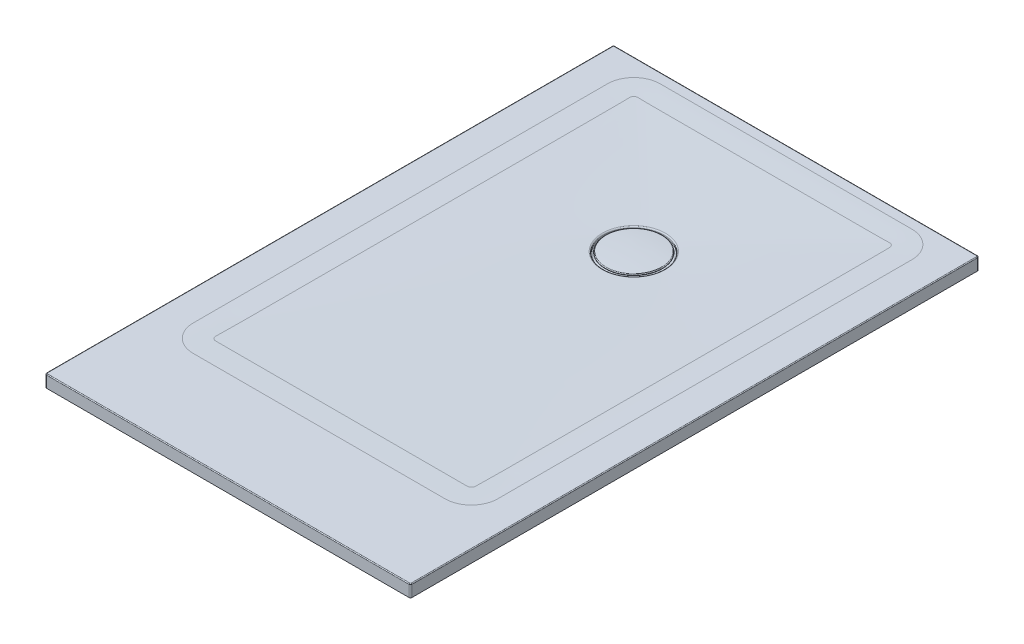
SolidWorks part; units mm, degrees
ref_plane "Płaszczyzna przednia" through (0, 0, 0) normal (0, 0, 1) x (1, 0, 0)
ref_plane "Płaszczyzna górna" through (0, 0, 0) normal (0, 1, 0) x (1, 0, 0)
ref_plane "Płaszczyzna prawa" through (0, 0, 0) normal (1, 0, 0) x (0, 0, -1)
sketch "Szkic2" plane through (0, 0, 0) normal (0, 1, 0) x (1, 0, 0)
  line L0 (0, 700) -> (0, 300) construction
  line L1 (-450, -700) -> (450, -700)
  line L2 (-450, -700) -> (-450, 700)
  line L3 (-450, 700) -> (450, 700)
  line L4 (450, -700) -> (450, 700)
  line L5 (-450, -700) -> (450, 700) construction
  line L6 (-450, 700) -> (450, -700) construction
  line L7 (-360, 660) -> (360, 660)
  line L8 (-360, 660) -> (-360, -460)
  line L9 (-360, -460) -> (360, -460)
  line L10 (360, 660) -> (360, -460)
  line L11 (-400, 700) -> (-400, -500) construction
  line L12 (-400, -500) -> (400, -500) construction
  line L13 (400, -500) -> (400, 700) construction
  circle A0 centre (0, 300) radius 75
  point P0 (0, 0)
  point P11 (0, 660)
  point P16 (0, -500)
  dimension "D9" = 150
  dimension "D1" = 900
  dimension "D2" = 1400
  dimension "D3" = 40
  dimension "D4" = 90
  dimension "D5" = 40
  dimension "D6" = 50
  dimension "D7" = 1200
  dimension "D8" = 400
  dimension "D10" = 800
sketch "Szkic3" plane through (0, 0, 0) normal (0, 1, 0) x (1, 0, 0)
  line L0 (-450, -700) -> (-450, 700) construction
  line L1 (-450, -700) -> (450, -700) construction
  line L2 (450, -700) -> (450, 700) construction
  line L3 (-450, 700) -> (450, 700) construction
  line L4 (-360, 660) -> (-360, -460) construction
  line L5 (-360, 660) -> (360, 660) construction
  line L6 (360, 660) -> (360, -460) construction
  line L7 (-360, -460) -> (360, -460) construction
  line L8 (-450, -700) -> (-450, 700)
  line L9 (-450, -700) -> (450, -700)
  line L10 (450, -700) -> (450, 700)
  line L11 (-450, 700) -> (450, 700)
  line L12 (-360, 610) -> (-360, -410)
  line L13 (-310, 660) -> (310, 660)
  line L14 (360, 610) -> (360, -410)
  line L15 (-310, -460) -> (310, -460)
  arc A0 (360, 610) -> (310, 660) centre (310, 610) ccw
  arc A1 (-310, 660) -> (-360, 610) centre (-310, 610) ccw
  arc A2 (310, -460) -> (360, -410) centre (310, -410) ccw
  arc A3 (-310, -460) -> (-360, -410) centre (-310, -410) cw
  dimension "D1" = 50
surface "Powierzchnia-Płaszczyzna1" sketch "Szkic3"
sketch "Szkic4" plane through (0, 0, 0) normal (0, 1, 0) x (1, 0, 0)
  line L0 (-360, 660) -> (-360, -460) construction
  line L1 (-360, -460) -> (360, -460) construction
  line L2 (360, 660) -> (360, -460) construction
  line L3 (-360, 660) -> (360, 660) construction
  line L4 (-360, 660) -> (-360, -460)
  line L5 (-360, -460) -> (360, -460)
  line L6 (360, 660) -> (360, -460)
  line L7 (-360, 660) -> (360, 660)
ref_plane "korek" through (0, -15, 0) normal (0, 1, 0) x (-1, 0, 0)
sketch "Szkic5" plane through (0, -15, 0) normal (0, 1, 0) x (-1, 0, 0)
  circle A0 centre (0, -300) radius 75 construction
  circle A1 centre (0, -300) radius 75
surface "Powierzchnia-Wyciągnięcie po profilach2"
surface "Powierzchnia-Połącz1"
sketch "Szkic7" plane through (0, 0, 0) normal (0, 1, 0) x (1, 0, 0)
  line L27 (310, 620) -> (-310, 620)
  line L28 (-320, 610) -> (-320, -410)
  line L29 (-310, -420) -> (310, -420)
  line L30 (320, -410) -> (320, 610)
  line L31 (310, 620) -> (-310, 620)
  line L32 (-320, 610) -> (-320, -410)
  line L33 (-310, -420) -> (310, -420)
  line L34 (320, -410) -> (320, 610)
  line L35 (310, 675) -> (-310, 675)
  line L36 (-375, 610) -> (-375, -410)
  line L37 (-310, -475) -> (310, -475)
  line L38 (375, -410) -> (375, 610)
  line L39 (310, 675) -> (-310, 675)
  line L40 (-375, 610) -> (-375, -410)
  line L41 (-310, -475) -> (310, -475)
  line L42 (375, -410) -> (375, 610)
  arc A0 (320, -410) -> (310, -420) centre (310, -410) cw
  arc A1 (-320, -410) -> (-310, -420) centre (-310, -410) ccw
  arc A2 (320, 610) -> (310, 620) centre (310, 610) ccw
  arc A3 (-320, 610) -> (-310, 620) centre (-310, 610) cw
  spline S23 degree 3 poles (-641.5878, 335.5068) (132.0266, 504.8459) (327.0345, 575.6218) (319.7449, 612.2672) (319.6662, 612.5839) (319.476, 613.2116) (319.3643, 613.5237) (318.9884, 614.4316) (318.6816, 615.0058) (318.1379, 615.8207) (317.942, 616.0854) (317.5242, 616.5951) (317.3043, 616.8376) (316.6131, 617.5295) (316.1101, 617.9434) (315.2912, 618.4919) (315.0073, 618.6622) (314.4305, 618.971) (314.1359, 619.1104) (313.5348, 619.3602) (313.2281, 619.4702) (312.6028, 619.661) (312.2825, 619.7412) (224.7278, 637.343) (4.1911, -546.09) (154.0864, 1607.7672) knots -6.986151 -6.986151 -6.986151 -6.986151 0.125 0.125 0.1875 0.1875 0.25 0.25 0.375 0.375 0.4375 0.4375 0.5 0.5 0.625 0.625 0.6875 0.6875 0.75 0.75 0.8125 0.8125 0.875 0.875 17.756089 17.756089 17.756089 17.756089 only from (320, 610) to (310, 620)
  spline S24 degree 3 poles (-15.8806, -335.7684) (-176.9248, 348.8616) (-268.9732, 628.3969) (-312.2676, 619.7446) (-312.5844, 619.666) (-313.2123, 619.4757) (-313.5244, 619.3641) (-314.4322, 618.988) (-315.0064, 618.6812) (-316.093, 617.9563) (-316.6076, 617.5344) (-317.5298, 616.6125) (-317.9438, 616.1096) (-318.4922, 615.2906) (-318.6624, 615.0068) (-318.9713, 614.43) (-319.1107, 614.1354) (-319.3603, 613.5342) (-319.4705, 613.2277) (-319.6612, 612.6023) (-319.7416, 612.2819) (-329.3416, 564.3068) (13.323, 477.4536) (647.7594, 358.1252) knots -8.287212 -8.287212 -8.287212 -8.287212 0.125 0.125 0.1875 0.1875 0.25 0.25 0.375 0.375 0.5 0.5 0.625 0.625 0.6875 0.6875 0.75 0.75 0.8125 0.8125 0.875 0.875 10.098305 10.098305 10.098305 10.098305 only from (-310, 620) to (-320, 610)
  spline S25 degree 3 poles (641.5879, -135.5068) (-132.0266, -304.8459) (-327.0345, -375.6218) (-319.7449, -412.2672) (-319.6662, -412.5839) (-319.476, -413.2116) (-319.3643, -413.5237) (-318.9884, -414.4316) (-318.6816, -415.0058) (-318.1379, -415.8207) (-317.942, -416.0854) (-317.5242, -416.5951) (-317.3043, -416.8376) (-316.6131, -417.5295) (-316.1101, -417.9434) (-315.2912, -418.4919) (-315.0073, -418.6622) (-314.4305, -418.971) (-314.1359, -419.1104) (-313.5348, -419.3602) (-313.2281, -419.4702) (-312.6028, -419.661) (-312.2825, -419.7412) (-224.7278, -437.343) (-4.1911, 746.09) (-154.0864, -1407.7672) knots -6.986151 -6.986151 -6.986151 -6.986151 0.125 0.125 0.1875 0.1875 0.25 0.25 0.375 0.375 0.4375 0.4375 0.5 0.5 0.625 0.625 0.6875 0.6875 0.75 0.75 0.8125 0.8125 0.875 0.875 17.756089 17.756089 17.756089 17.756089 only from (-320, -410) to (-310, -420)
  spline S26 degree 3 poles (15.8809, 535.7674) (176.9249, -148.862) (268.9732, -428.3969) (312.2676, -419.7446) (312.5844, -419.666) (313.2123, -419.4757) (313.5244, -419.3641) (314.4322, -418.988) (315.0064, -418.6812) (316.093, -417.9563) (316.6076, -417.5344) (317.5298, -416.6125) (317.9438, -416.1096) (318.4922, -415.2906) (318.6624, -415.0068) (318.9713, -414.43) (319.1107, -414.1354) (319.3603, -413.5342) (319.4705, -413.2277) (319.6612, -412.6023) (319.7416, -412.2819) (329.3416, -364.3068) (-13.3226, -277.4537) (-647.7582, -158.1254) knots -8.287206 -8.287206 -8.287206 -8.287206 0.125 0.125 0.1875 0.1875 0.25 0.25 0.375 0.375 0.5 0.5 0.625 0.625 0.6875 0.6875 0.75 0.75 0.8125 0.8125 0.875 0.875 10.098299 10.098299 10.098299 10.098299 only from (310, -420) to (320, -410)
  spline S31 degree 3 poles (-2446.8046, -366.6711) (-191.8391, 187.1441) (406.3399, 458.6443) (373.3423, 624.7384) (372.8287, 626.7967) (371.9018, 629.8575) (371.566, 630.875) (370.8442, 632.8936) (370.4599, 633.8899) (368.4231, 638.8077) (366.4288, 642.5396) (363.4839, 646.9539) (362.8722, 647.8242) (361.6024, 649.539) (360.9425, 650.3857) (358.9056, 652.8699) (357.4766, 654.4462) (352.9831, 658.9431) (349.7139, 661.6337) (345.2779, 664.6042) (344.3704, 665.1799) (342.5358, 666.2811) (341.6084, 666.8071) (338.7962, 668.3121) (336.8816, 669.2187) (332.9743, 670.8413) (330.9814, 671.5572) (327.9326, 672.4865) (326.9064, 672.772) (324.8337, 673.2937) (323.7853, 673.5302) (320.6363, 674.16) (318.5252, 674.4737) (162.4603, 689.9027) (-51.7687, 162.1939) (-470.5417, -2207.5903) knots -4.813954 -4.813954 -4.813954 -4.813954 0.125 0.125 0.1875 0.1875 0.21875 0.21875 0.25 0.25 0.375 0.375 0.40625 0.40625 0.4375 0.4375 0.5 0.5 0.625 0.625 0.65625 0.65625 0.6875 0.6875 0.75 0.75 0.8125 0.8125 0.84375 0.84375 0.875 0.875 0.9375 0.9375 5.470292 5.470292 5.470292 5.470292 only from (375, 610) to (310, 675)
  spline S32 degree 3 poles (598.0202, -2171.6817) (42.1984, 250.7837) (-175.5604, 688.5675) (-318.4946, 674.4773) (-320.5877, 674.1672) (-324.7389, 673.3419) (-326.7974, 672.8284) (-329.8583, 671.9014) (-330.8759, 671.5657) (-332.8945, 670.844) (-333.8908, 670.4596) (-338.8083, 668.4227) (-342.5402, 666.4284) (-346.9546, 663.4835) (-347.8248, 662.8717) (-349.5396, 661.6019) (-350.3863, 660.9421) (-352.8704, 658.9051) (-354.4467, 657.4761) (-358.9434, 652.9825) (-361.6341, 649.7134) (-364.6045, 645.2773) (-365.1803, 644.3698) (-366.2814, 642.5352) (-366.8073, 641.6078) (-368.3125, 638.7957) (-369.219, 636.8811) (-370.8415, 632.9737) (-371.5575, 630.9809) (-372.4867, 627.9321) (-372.7721, 626.9058) (-373.2937, 624.8331) (-373.5305, 623.7847) (-412.8036, 427.2697) (454.8766, 131.0677) (2469.4105, -292.5466) knots -4.107891 -4.107891 -4.107891 -4.107891 0.0625 0.0625 0.125 0.125 0.1875 0.1875 0.21875 0.21875 0.25 0.25 0.375 0.375 0.40625 0.40625 0.4375 0.4375 0.5 0.5 0.625 0.625 0.65625 0.65625 0.6875 0.6875 0.75 0.75 0.8125 0.8125 0.84375 0.84375 0.875 0.875 6.694536 6.694536 6.694536 6.694536 only from (-310, 675) to (-375, 610)
  spline S33 degree 3 poles (2446.8047, 566.6711) (191.8391, 12.8559) (-406.3399, -258.6443) (-373.3423, -424.7384) (-372.8287, -426.7967) (-371.9018, -429.8575) (-371.566, -430.875) (-370.8442, -432.8936) (-370.4599, -433.8899) (-368.4231, -438.8077) (-366.4288, -442.5396) (-363.4839, -446.9539) (-362.8722, -447.8242) (-361.6024, -449.539) (-360.9425, -450.3857) (-358.9056, -452.8699) (-357.4766, -454.4462) (-352.9831, -458.9431) (-349.7139, -461.6337) (-345.2779, -464.6042) (-344.3704, -465.1799) (-342.5358, -466.2811) (-341.6084, -466.8071) (-338.7962, -468.3121) (-336.8816, -469.2187) (-332.9743, -470.8413) (-330.9814, -471.5572) (-327.9326, -472.4865) (-326.9064, -472.772) (-324.8337, -473.2937) (-323.7853, -473.5302) (-320.6363, -474.16) (-318.5252, -474.4737) (-162.4603, -489.9027) (51.7687, 37.8061) (470.5417, 2407.5903) knots -4.813954 -4.813954 -4.813954 -4.813954 0.125 0.125 0.1875 0.1875 0.21875 0.21875 0.25 0.25 0.375 0.375 0.40625 0.40625 0.4375 0.4375 0.5 0.5 0.625 0.625 0.65625 0.65625 0.6875 0.6875 0.75 0.75 0.8125 0.8125 0.84375 0.84375 0.875 0.875 0.9375 0.9375 5.470292 5.470292 5.470292 5.470292 only from (-375, -410) to (-310, -475)
  spline S34 degree 3 poles (-598.0202, 2371.6817) (-42.1984, -50.7837) (175.5604, -488.5675) (318.4946, -474.4773) (320.5877, -474.1672) (324.7389, -473.3419) (326.7974, -472.8284) (329.8583, -471.9014) (330.8759, -471.5657) (332.8945, -470.844) (333.8908, -470.4596) (338.8083, -468.4227) (342.5402, -466.4284) (346.9546, -463.4835) (347.8248, -462.8717) (349.5396, -461.6019) (350.3863, -460.9421) (352.8704, -458.9051) (354.4467, -457.4761) (358.9434, -452.9825) (361.6341, -449.7134) (364.6045, -445.2773) (365.1803, -444.3698) (366.2814, -442.5352) (366.8073, -441.6078) (368.3125, -438.7957) (369.219, -436.8811) (370.8415, -432.9737) (371.5575, -430.9809) (372.4867, -427.9321) (372.7721, -426.9058) (373.2937, -424.8331) (373.5305, -423.7847) (412.8036, -227.2697) (-454.8766, 68.9323) (-2469.4105, 492.5466) knots -4.107891 -4.107891 -4.107891 -4.107891 0.0625 0.0625 0.125 0.125 0.1875 0.1875 0.21875 0.21875 0.25 0.25 0.375 0.375 0.40625 0.40625 0.4375 0.4375 0.5 0.5 0.625 0.625 0.65625 0.65625 0.6875 0.6875 0.75 0.75 0.8125 0.8125 0.84375 0.84375 0.875 0.875 6.694536 6.694536 6.694536 6.694536 only from (310, -475) to (375, -410)
  spline S35 degree 3 poles (375, 610) (375, 614.2917) (374.5793, 618.5117) (373.3423, 624.7384) (372.8287, 626.7967) (371.9018, 629.8575) (371.566, 630.875) (370.8442, 632.8936) (370.4599, 633.8899) (368.4231, 638.8077) (366.4288, 642.5396) (363.4839, 646.9539) (362.8722, 647.8242) (361.6024, 649.539) (360.9425, 650.3857) (358.9056, 652.8699) (357.4766, 654.4462) (352.9831, 658.9431) (349.7139, 661.6337) (345.2779, 664.6042) (344.3704, 665.1799) (342.5358, 666.2811) (341.6084, 666.8071) (338.7962, 668.3121) (336.8816, 669.2187) (332.9743, 670.8413) (330.9814, 671.5572) (327.9326, 672.4865) (326.9064, 672.772) (324.8337, 673.2937) (323.7853, 673.5302) (320.6363, 674.16) (318.5252, 674.4737) (314.28, 674.8934) (312.1459, 675) (310, 675) knots 0 0 0 0 0.125 0.125 0.1875 0.1875 0.21875 0.21875 0.25 0.25 0.375 0.375 0.40625 0.40625 0.4375 0.4375 0.5 0.5 0.625 0.625 0.65625 0.65625 0.6875 0.6875 0.75 0.75 0.8125 0.8125 0.84375 0.84375 0.875 0.875 0.9375 0.9375 1 1 1 1
  spline S36 degree 3 poles (-310, 675) (-312.1459, 675) (-314.2737, 674.8934) (-318.4946, 674.4773) (-320.5877, 674.1672) (-324.7389, 673.3419) (-326.7974, 672.8284) (-329.8583, 671.9014) (-330.8759, 671.5657) (-332.8945, 670.844) (-333.8908, 670.4596) (-338.8083, 668.4227) (-342.5402, 666.4284) (-346.9546, 663.4835) (-347.8248, 662.8717) (-349.5396, 661.6019) (-350.3863, 660.9421) (-352.8704, 658.9051) (-354.4467, 657.4761) (-358.9434, 652.9825) (-361.6341, 649.7134) (-364.6045, 645.2773) (-365.1803, 644.3698) (-366.2814, 642.5352) (-366.8073, 641.6078) (-368.3125, 638.7957) (-369.219, 636.8811) (-370.8415, 632.9737) (-371.5575, 630.9809) (-372.4867, 627.9321) (-372.7721, 626.9058) (-373.2937, 624.8331) (-373.5305, 623.7847) (-374.5793, 618.5366) (-375, 614.2917) (-375, 610) knots 0 0 0 0 0.0625 0.0625 0.125 0.125 0.1875 0.1875 0.21875 0.21875 0.25 0.25 0.375 0.375 0.40625 0.40625 0.4375 0.4375 0.5 0.5 0.625 0.625 0.65625 0.65625 0.6875 0.6875 0.75 0.75 0.8125 0.8125 0.84375 0.84375 0.875 0.875 1 1 1 1
  spline S37 degree 3 poles (-375, -410) (-375, -414.2917) (-374.5793, -418.5117) (-373.3423, -424.7384) (-372.8287, -426.7967) (-371.9018, -429.8575) (-371.566, -430.875) (-370.8442, -432.8936) (-370.4599, -433.8899) (-368.4231, -438.8077) (-366.4288, -442.5396) (-363.4839, -446.9539) (-362.8722, -447.8242) (-361.6024, -449.539) (-360.9425, -450.3857) (-358.9056, -452.8699) (-357.4766, -454.4462) (-352.9831, -458.9431) (-349.7139, -461.6337) (-345.2779, -464.6042) (-344.3704, -465.1799) (-342.5358, -466.2811) (-341.6084, -466.8071) (-338.7962, -468.3121) (-336.8816, -469.2187) (-332.9743, -470.8413) (-330.9814, -471.5572) (-327.9326, -472.4865) (-326.9064, -472.772) (-324.8337, -473.2937) (-323.7853, -473.5302) (-320.6363, -474.16) (-318.5252, -474.4737) (-314.28, -474.8934) (-312.1459, -475) (-310, -475) knots 0 0 0 0 0.125 0.125 0.1875 0.1875 0.21875 0.21875 0.25 0.25 0.375 0.375 0.40625 0.40625 0.4375 0.4375 0.5 0.5 0.625 0.625 0.65625 0.65625 0.6875 0.6875 0.75 0.75 0.8125 0.8125 0.84375 0.84375 0.875 0.875 0.9375 0.9375 1 1 1 1
  spline S38 degree 3 poles (310, -475) (312.1459, -475) (314.2737, -474.8934) (318.4946, -474.4773) (320.5877, -474.1672) (324.7389, -473.3419) (326.7974, -472.8284) (329.8583, -471.9014) (330.8759, -471.5657) (332.8945, -470.844) (333.8908, -470.4596) (338.8083, -468.4227) (342.5402, -466.4284) (346.9546, -463.4835) (347.8248, -462.8717) (349.5396, -461.6019) (350.3863, -460.9421) (352.8704, -458.9051) (354.4467, -457.4761) (358.9434, -452.9825) (361.6341, -449.7134) (364.6045, -445.2773) (365.1803, -444.3698) (366.2814, -442.5352) (366.8073, -441.6078) (368.3125, -438.7957) (369.219, -436.8811) (370.8415, -432.9737) (371.5575, -430.9809) (372.4867, -427.9321) (372.7721, -426.9058) (373.2937, -424.8331) (373.5305, -423.7847) (374.5793, -418.5366) (375, -414.2917) (375, -410) knots 0 0 0 0 0.0625 0.0625 0.125 0.125 0.1875 0.1875 0.21875 0.21875 0.25 0.25 0.375 0.375 0.40625 0.40625 0.4375 0.4375 0.5 0.5 0.625 0.625 0.65625 0.65625 0.6875 0.6875 0.75 0.75 0.8125 0.8125 0.84375 0.84375 0.875 0.875 1 1 1 1
  dimension "D3" = 10
  dimension "D1" = 40
  dimension "D2" = 15
other "Usuń ścianę1"
other "Granica-Powierzchnia1"
surface "Powierzchnia-Połącz2"
sketch "Szkic9" plane through (0, 0, 0) normal (0, 1, 0) x (1, 0, 0)
  line L0 (-450, -700) -> (450, -700) construction
  line L1 (-450, -700) -> (-450, 700) construction
  line L2 (450, -700) -> (450, 700) construction
  line L3 (-450, 700) -> (450, 700) construction
  line L4 (-450, -700) -> (450, -700)
  line L5 (-450, -700) -> (-450, 700)
  line L6 (450, -700) -> (450, 700)
  line L7 (-450, 700) -> (450, 700)
surface "Powierzchnia-Wyciągnięcie1" sketch "Szkic9" parameters "D1"=30
sketch "Szkic8" plane through (0, 0, 0) normal (1, 0, 0) x (0, 0, -1)
  line L0 (300, 0) -> (300, -30) construction
  line L1 (224.9999, -15) -> (225.2968, -23.5)
  line L4 (225.2968, -23.5) -> (248, -24.0945)
  line L5 (225.2968, -23.5) -> (300, -23.5) construction
  line L6 (248, -24.0945) -> (248, -30) construction
  line L7 (300, -30) -> (225.2968, -30) construction
  line L8 (225.2968, -30) -> (225.2968, -23.5) construction
  line L9 (255, -28) -> (255, -30)
  line L10 (248, -24.0945) -> (255, -28)
  dimension "D1" = 30
  dimension "D2" = 8.5
  dimension "D3" = 2
  dimension "D4" = 1.5
  dimension "D5" = 52
  dimension "D6" = 45
  dimension "D7" = 2
surface "Powierzchnia-Obrót1" sketch "Szkic8" parameters "D1"=360
surface "Powierzchnia-Płaszczyzna2"
surface "Powierzchnia-Połącz3"
fillet "Zaokrąglenie4" radius 4 4 edges at (-450, -15, -700) (450, -15, -700) (-450, -15, 700) (450, -15, 700)
fillet "Zaokrąglenie5" radius 3 3 edges at (0, -24.0945, -352) (0, -23.5, -374.7032)
fillet "Zaokrąglenie6" radius 2 9 edges at (448.8284, 0, 698.8284) (0, 0, 700) (-448.8284, 0, 698.8284) (-450, 0, 0) (-448.8284, 0, -698.8284) (0, 0, -700) (448.8284, 0, -698.8284) (450, 0, 0) (0, -28, -345)
sketch "Szkic11" plane through (0, 0, 0) normal (1, 0, 0) x (0, 0, -1)
  line L0 (300, 0) -> (300, -30) construction
  line L1 (-696, -30) -> (696, -30) construction
  line L2 (300, -17) -> (300, -11.5)
  line L14 (370, -11.5) -> (370, -14.5) construction
  line L16 (370, -17) -> (300, -17)
  line L18 (370, -17) -> (370, -16.3377)
  line L19 (300, -11.5) -> (370, -11.5) construction
  arc A0 (370, -16.3377) -> (368.1666, -14.3446) centre (368, -16.3377) ccw
  arc A6 (368.1666, -14.3446) -> (300, -11.5) centre (300, -829.6667) ccw
  dimension "D2" = 2
  dimension "D8" = 2.5
  dimension "D9" = 17
  dimension "D10" = 5.5
  dimension "D11" = 70
revolve "Obrót1" add sketch "Szkic11" angle 360 about L0
